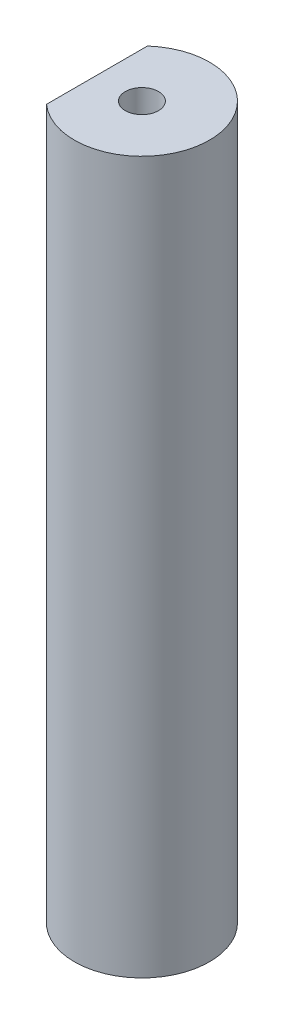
SolidWorks part; units mm, degrees
ref_plane "Спереди" through (0, 0, 0) normal (0, 0, 1) x (1, 0, 0)
ref_plane "Сверху" through (0, 0, 0) normal (0, 1, 0) x (1, 0, 0)
ref_plane "Справа" through (0, 0, 0) normal (1, 0, 0) x (0, 0, -1)
sketch "Эскиз1" plane through (0, 0, 0) normal (0, 1, 0) x (1, 0, 0)
  line L0 (-3.791, 4.2566) -> (-3.791, -4.2566)
  arc A0 (-3.791, -4.2566) -> (-3.791, 4.2566) centre (0, 0) ccw
  dimension "D1" = 11.4
extrude "Бобышка-Вытянуть1" add sketch "Эскиз1" along normal blind 60
sketch "Эскиз2" plane through (0, 60, 0) normal (0, 1, 0) x (1, 0, 0)
  circle A0 centre (0, 0) radius 1.4
  dimension "D1" = 2.8
extrude "Вырез-Вытянуть1" cut sketch "Эскиз2" against normal blind 25
sketch "Эскиз3" plane through (0, 0, 0) normal (0, -1, 0) x (1, 0, 0)
  circle A0 centre (0, 0) radius 1.4
  dimension "D1" = 2.8
extrude "Вырез-Вытянуть2" cut sketch "Эскиз3" against normal blind 25
